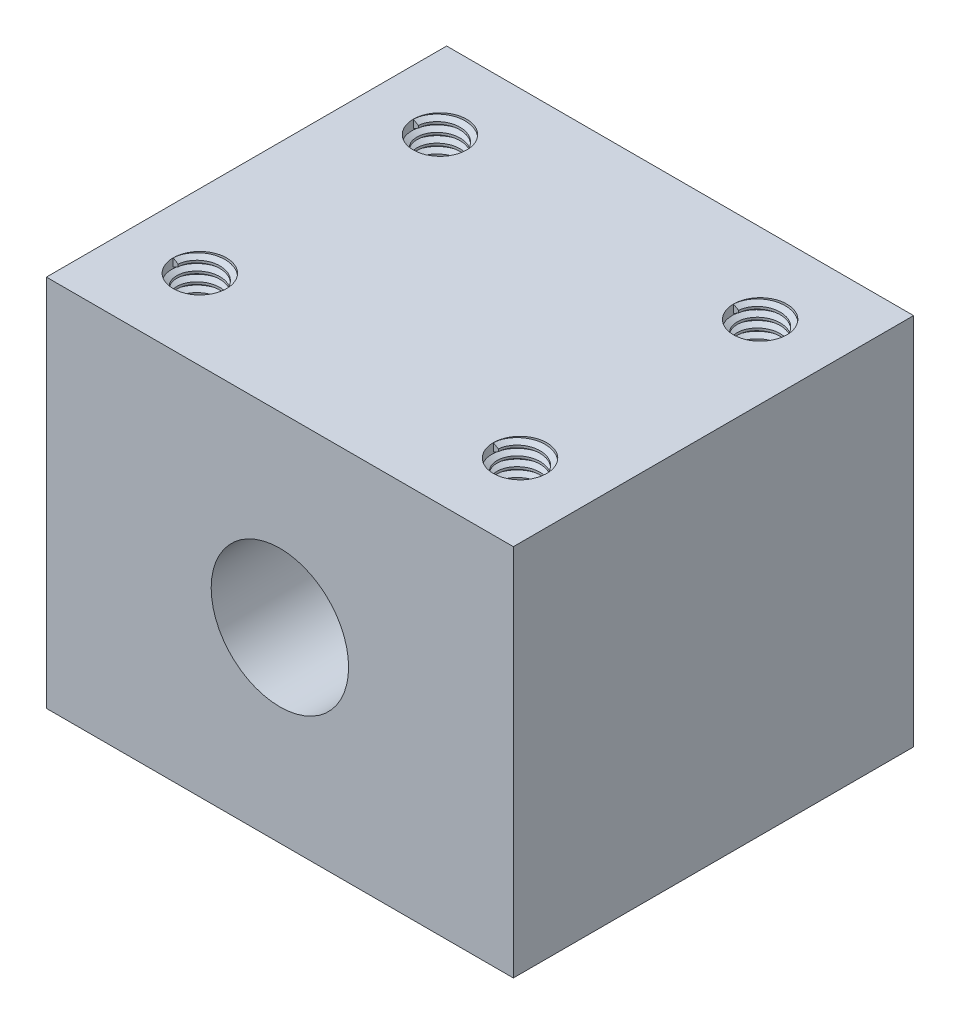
SolidWorks part; units mm, degrees
ref_plane "Спереди" through (0, 0, 0) normal (0, 0, 1) x (1, 0, 0)
ref_plane "Сверху" through (0, 0, 0) normal (0, 1, 0) x (1, 0, 0)
ref_plane "Справа" through (0, 0, 0) normal (1, 0, 0) x (0, 0, -1)
sketch "Эскиз1" plane through (0, 0, 0) normal (0, 0, 1) x (1, 0, 0)
  line L0 (-22.4832, 0) -> (26.725, 0) construction
  line L1 (-17.5, -14) -> (17.5, -14)
  line L2 (-17.5, -14) -> (-17.5, 14)
  line L3 (-17.5, 14) -> (17.5, 14)
  line L4 (17.5, -14) -> (17.5, 14)
  line L5 (-17.5, -14) -> (17.5, 14) construction
  line L6 (-17.5, 14) -> (17.5, -14) construction
  circle A0 centre (0, 0) radius 5.15
  point P0 (0, 0)
  dimension "D3" = 10.3
  dimension "D1" = 35
  dimension "D2" = 28
extrude "Бобышка-Вытянуть1" add sketch "Эскиз1" along normal blind 30
sketch "Эскиз2" plane through (0, 0, 0) normal (0, 0, -1) x (-1, 0, 0)
  circle A0 centre (0, 0) radius 11
  dimension "D1" = 22
extrude "Вырез-Вытянуть1" cut sketch "Эскиз2" against normal blind 4
sketch "Эскиз3" plane through (0, 0, 4) normal (0, 0, -1) x (-1, 0, 0)
  line L0 (-22.8483, 0) -> (24.8067, 0) construction
  circle A0 centre (-8, 0) radius 1.5
  circle A1 centre (8, 0) radius 1.5
  dimension "D3" = 8
  dimension "D4" = 8
extrude "Вырез-Вытянуть2" cut sketch "Эскиз3" against normal blind 10
sketch "Эскиз4" plane through (0, 14, 0) normal (0, 1, 0) x (1, 0, 0)
  line L1 (-28.5622, -24) -> (32.9625, -24) construction
  line L2 (-28.5622, -6) -> (27.5561, -6) construction
  line L3 (-12, 7.2495) -> (-12, -38.4886) construction
  line L4 (12, 7.2495) -> (12, -38.4907) construction
  line L5 (-17.5, -30) -> (-17.5, 0) construction
  circle A0 centre (-12, -6) radius 2
  circle A1 centre (12, -6) radius 2
  circle A2 centre (-12, -24) radius 2
  circle A3 centre (12, -24) radius 2
  point P20 (12.3166, 7.2495)
  dimension "D5" = 4
  dimension "D6" = 4
  dimension "D7" = 4
  dimension "D8" = 4
  dimension "D1" = 5.5
  dimension "D2" = 5.5
  dimension "D3" = 6
  dimension "D4" = 6
extrude "Вырез-Вытянуть3" cut sketch "Эскиз4" against normal blind 7 contours A1 | A0 | A2 | A3
thread "Резьба1" pitch 0.7 start angle 0, offset 0, length 7, pitch 0.7, diameter 4
ref_plane "Плоскость1" through (-14, 14, 6) normal (0, 0, 1) x (-1, 0, 0)
sketch "Профиль резьбы1" plane through (-14, 14, 6) normal (0, 0, 1) x (-1, 0, 0)
  line L0 (0, 0) -> (0, 0.7) construction
  line L11 (0, 0) -> (0, 0.6125)
  line L12 (0, 0.6125) -> (-0.3789, 0.3937)
  line L13 (-0.3789, 0.3937) -> (-0.3789, 0.2187)
  line L15 (-0.3789, 0.2187) -> (0, 0)
  line L17 (-0.3789, 0.3062) -> (0, 0.3062) construction
  point P2 (0, 0)
  dimension "Pitch" = 0.7
  dimension "Profile_Angle" = 60
  dimension "Profile_Land" = 0.175
  dimension "Profile_Height" = 0.3789
thread "Резьба2" pitch 0.7 start angle 0, offset 0, length 7, pitch 0.7, diameter 4
ref_plane "Плоскость2" through (10, 14, 24) normal (0, 0, 1) x (-1, 0, 0)
sketch "Профиль резьбы2" plane through (10, 14, 24) normal (0, 0, 1) x (-1, 0, 0)
  line L0 (0, 0) -> (0, 0.7) construction
  line L11 (0, 0) -> (0, 0.6125)
  line L12 (0, 0.6125) -> (-0.3789, 0.3937)
  line L13 (-0.3789, 0.3937) -> (-0.3789, 0.2187)
  line L15 (-0.3789, 0.2187) -> (0, 0)
  line L17 (-0.3789, 0.3062) -> (0, 0.3062) construction
  point P2 (0, 0)
  dimension "Pitch" = 0.7
  dimension "Profile_Angle" = 60
  dimension "Profile_Land" = 0.175
  dimension "Profile_Height" = 0.3789
thread "Резьба3" pitch 0.7 start angle 0, offset 0, length 7, pitch 0.7, diameter 4
ref_plane "Плоскость3" through (10, 14, 6) normal (0, 0, 1) x (-1, 0, 0)
sketch "Профиль резьбы3" plane through (10, 14, 6) normal (0, 0, 1) x (-1, 0, 0)
  line L0 (0, 0) -> (0, 0.7) construction
  line L11 (0, 0) -> (0, 0.6125)
  line L12 (0, 0.6125) -> (-0.3789, 0.3937)
  line L13 (-0.3789, 0.3937) -> (-0.3789, 0.2187)
  line L15 (-0.3789, 0.2187) -> (0, 0)
  line L17 (-0.3789, 0.3062) -> (0, 0.3062) construction
  point P2 (0, 0)
  dimension "Pitch" = 0.7
  dimension "Profile_Angle" = 60
  dimension "Profile_Land" = 0.175
  dimension "Profile_Height" = 0.3789
thread "Резьба4" pitch 0.7 start angle 0, offset 0, length 7, pitch 0.7, diameter 4
ref_plane "Плоскость4" through (-14, 14, 24) normal (0, 0, 1) x (-1, 0, 0)
sketch "Профиль резьбы4" plane through (-14, 14, 24) normal (0, 0, 1) x (-1, 0, 0)
  line L0 (0, 0) -> (0, 0.7) construction
  line L11 (0, 0) -> (0, 0.6125)
  line L12 (0, 0.6125) -> (-0.3789, 0.3937)
  line L13 (-0.3789, 0.3937) -> (-0.3789, 0.2187)
  line L15 (-0.3789, 0.2187) -> (0, 0)
  line L17 (-0.3789, 0.3062) -> (0, 0.3062) construction
  point P2 (0, 0)
  dimension "Pitch" = 0.7
  dimension "Profile_Angle" = 60
  dimension "Profile_Land" = 0.175
  dimension "Profile_Height" = 0.3789
thread "Резьба5" pitch 0.5 start angle 0, offset 0, length 10, pitch 0.5, diameter 3
ref_plane "Плоскость5" through (-6.5, 0, 4) normal (0, -1, 0) x (1, 0, 0)
sketch "Профиль резьбы5" plane through (-6.5, 0, 4) normal (0, -1, 0) x (1, 0, 0)
  line L0 (0, 0) -> (0, 0.5) construction
  line L11 (0, 0) -> (0, 0.4375)
  line L12 (0, 0.4375) -> (-0.2706, 0.2812)
  line L13 (-0.2706, 0.2812) -> (-0.2706, 0.1562)
  line L15 (-0.2706, 0.1562) -> (0, 0)
  line L17 (-0.2706, 0.2187) -> (0, 0.2187) construction
  point P2 (0, 0)
  dimension "Pitch" = 0.5
  dimension "Profile_Angle" = 60
  dimension "Profile_Land" = 0.125
  dimension "Profile_Height" = 0.2706
thread "Резьба6" pitch 0.5 start angle 0, offset 0, length 10, pitch 0.5, diameter 3
ref_plane "Плоскость6" through (9.5, 0, 4) normal (0, -1, 0) x (1, 0, 0)
sketch "Профиль резьбы6" plane through (9.5, 0, 4) normal (0, -1, 0) x (1, 0, 0)
  line L0 (0, 0) -> (0, 0.5) construction
  line L11 (0, 0) -> (0, 0.4375)
  line L12 (0, 0.4375) -> (-0.2706, 0.2812)
  line L13 (-0.2706, 0.2812) -> (-0.2706, 0.1562)
  line L15 (-0.2706, 0.1562) -> (0, 0)
  line L17 (-0.2706, 0.2187) -> (0, 0.2187) construction
  point P2 (0, 0)
  dimension "Pitch" = 0.5
  dimension "Profile_Angle" = 60
  dimension "Profile_Land" = 0.125
  dimension "Profile_Height" = 0.2706
